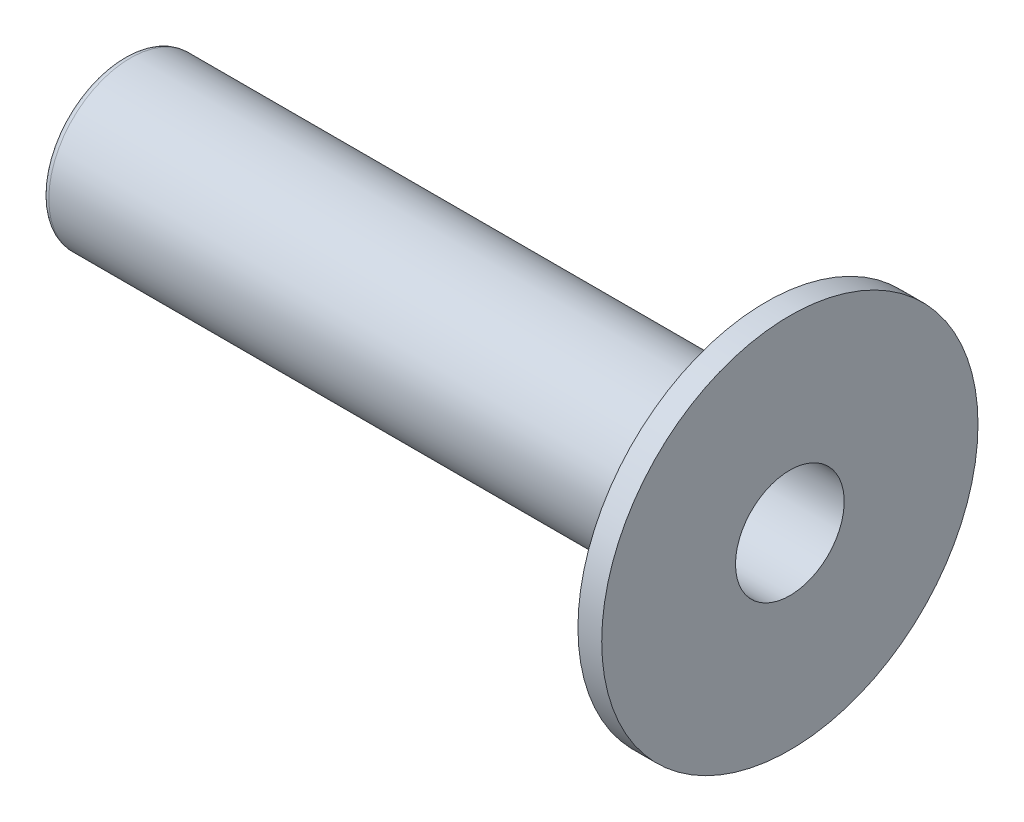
SolidWorks part; units mm, degrees
ref_plane "Plane1" through (0, 0, 0) normal (0, 0, 1) x (1, 0, 0)
ref_plane "Plane2" through (0, 0, 0) normal (0, 1, 0) x (1, 0, 0)
ref_plane "Plane3" through (0, 0, 0) normal (1, 0, 0) x (0, 0, -1)
sketch "Sketch1" plane through (0, 0, 0) normal (0, 0, 1) x (1, 0, 0)
  line L0 (0, 0) -> (109.22, 0) construction
  line L1 (24.9174, 7.0358) -> (24.9174, 2.032)
  line L2 (0.254, 3.048) -> (23.7744, 3.048)
  line L3 (24.0284, 3.302) -> (24.0284, 7.0358)
  line L4 (24.0284, 7.0358) -> (24.9174, 7.0358)
  line L5 (0, 1.3525) -> (4.7244, 1.3525)
  line L6 (0, 1.3525) -> (0, 2.794)
  line L7 (4.7244, 1.3525) -> (4.7244, 2.032)
  line L8 (4.7244, 2.032) -> (24.9174, 2.032)
  arc A0 (24.0284, 3.302) -> (23.7744, 3.048) centre (23.7744, 3.302) cw
  arc A1 (0.254, 3.048) -> (0, 2.794) centre (0.254, 2.794) ccw
  point P15 (0, 3.048)
  dimension "D1" = 0.889
  dimension "D2" = 2.032
  dimension "D3" = 7.0358
  dimension "D4" = 3.048
  dimension "D5" = 1.3525
  dimension "D6" = 4.7244
  dimension "D7" = 24.9174
revolve "Base-Revolve" add sketch "Sketch1" angle 360 about L0
sketch "Sketch2" plane through (0, 0, 0) normal (-1, 0, 0) x (0, 0, 1)
  circle A0 centre (0, 0) radius 1.905
  dimension "D1" = 3.81
